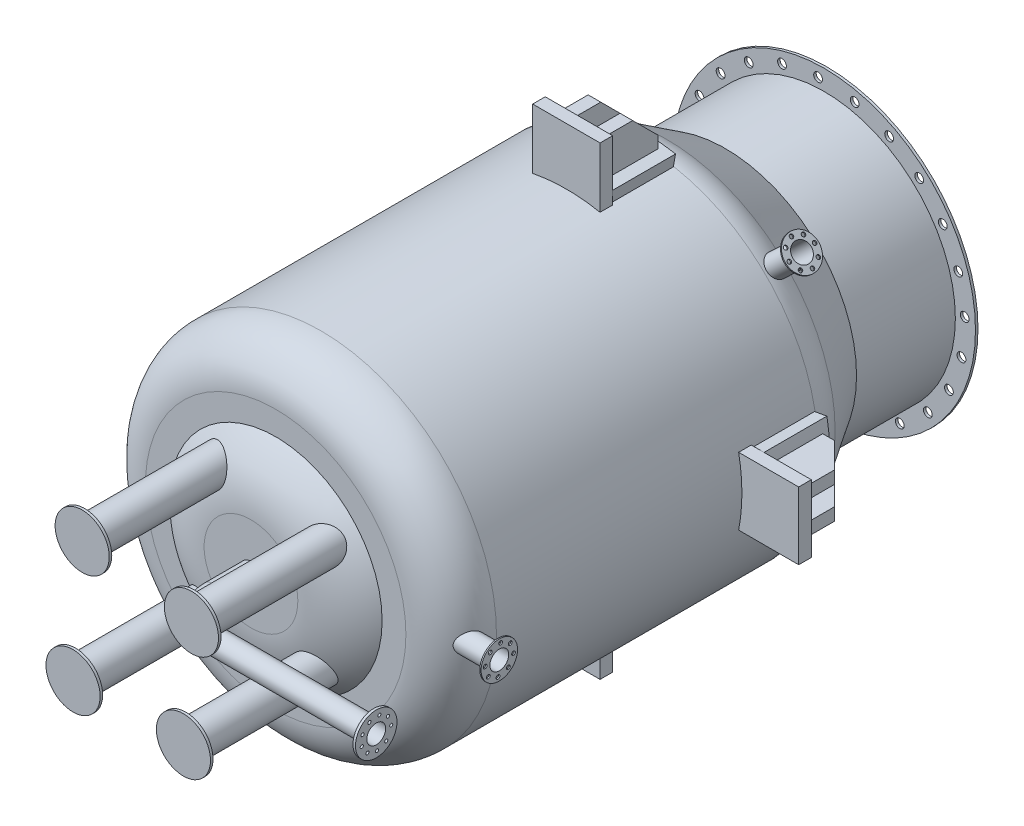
SolidWorks part; units mm, degrees
ref_plane "Ebene vorne" through (0, 0, 0) normal (0, 0, 1) x (1, 0, 0)
ref_plane "Ebene oben" through (0, 0, 0) normal (0, 1, 0) x (1, 0, 0)
ref_plane "Ebene rechts" through (0, 0, 0) normal (1, 0, 0) x (0, 0, -1)
sketch "Skizze4" plane through (0, 0, 0) normal (0, 0, 1) x (1, 0, 0)
  circle A0 centre (0, 0) radius 1042.5
  dimension "D1" = 2085
extrude "Linear austragen1" add sketch "Skizze4" along normal blind 4577
fillet "Verrundung1" radius 670 1 edges at (1042.5, 0, 4577)
shell "Wandung1" thickness 10
sketch "Skizze5" plane through (0, 0, 4577) normal (0, 0, 1) x (1, 0, 0)
  circle A0 centre (0, 0) radius 75
  dimension "D1" = 150
extrude "Linear austragen2" cut sketch "Skizze5" against normal up to next
sketch "Skizze8" plane through (0, 0, 0) normal (0, 1, 0) x (1, 0, 0)
  line L0 (1579.724, -5180.9866) -> (299, -5180.9866)
  line L1 (0, -4881.9866) -> (0, -4567)
  line L2 (75, -4567) -> (-75, -4567) construction
  arc A0 (299, -5180.9866) -> (0, -4881.9866) centre (299, -4881.9866) cw
  dimension "D1" = 299
ref_plane "Ebene2" through (1579.724, 0, 5180.9866) normal (-1, 0, 0) x (0, 0, 1)
sketch "Skizze11" plane through (1579.724, 0, 5180.9866) normal (-1, 0, 0) x (0, 0, 1)
  circle A0 centre (0, 0) radius 75
  dimension "D1" = 150
sweep "Austragung-Dünn2" add profiles "Skizze11" path "Skizze8" parameters "D1"=11
fillet "Verrundung5" radius 20 1 edges at (75, 0, 4567)
sketch "Skizze20" plane through (1579.724, 0, 5180.9866) normal (-1, 0, 0) x (0, 0, 1)
  circle A0 centre (0, 0) radius 75 construction
  circle A2 centre (0, 0) radius 75
  circle A3 centre (0, 0) radius 165
  dimension "D1" = 90
extrude "Linear austragen9" add sketch "Skizze20" against normal blind 20
sketch "Skizze21" plane through (1599.724, 0, 0) normal (1, 0, 0) x (0, 0, -1)
  circle A0 centre (-5061.9812, 0) radius 12.5
  dimension "D1" = 25
extrude "Linear austragen10" cut sketch "Skizze21" against normal up to next
pattern_circular "Kreismuster4" count 9 every 39 about axis through (0, 0, 5180.9866) along (1, 0, 0) of "Linear austragen10"
ref_plane "Ebene6" through (0, 0, 5531.373) normal (0, 0, 1) x (1, 0, 0)
sketch "Skizze23" plane through (0, 0, 5531.373) normal (0, 0, 1) x (1, 0, 0)
  circle A0 centre (-367.5803, 527.9889) radius 125.1685
extrude "Linear-Austragen-Dünn3" add sketch "Skizze23" against normal up to next thin
sketch "Skizze24" plane through (0, 0, 5531.373) normal (0, 0, 1) x (1, 0, 0)
  circle A2 centre (-367.5803, 527.9889) radius 215.1685
  circle A3 centre (-367.5803, 527.9889) radius 215.1685
  dimension "D1" = 90
extrude "Linear austragen11" add sketch "Skizze24" along normal blind 20
pattern_circular "Kreismuster5" count 4 every 86 about axis through (0, 0, 0) along (0, 0, 1) of "Linear-Austragen-Dünn3", "Linear austragen11"
sketch "Skizze28" plane through (0, 0, 0) normal (1, 0, 0) x (0, 0, -1)
  line L0 (0, 1042.5) -> (-3907, 1042.5) construction
  line L1 (-805.5154, 1042.5) -> (-880.0993, 1042.5)
  line L2 (-4380.7615, 846.2615) -> (-4380.7615, 1035.3621)
  line L3 (-4020.7615, 1395.3621) -> (-1465.537, 1395.3621)
  line L4 (-1272.4658, 1339.2099) -> (-805.5154, 1042.5)
  line L5 (-4340.7615, 883.1378) -> (-4340.7615, 1035.3621)
  line L6 (-4020.7615, 1355.3621) -> (-1465.537, 1355.3621)
  line L7 (-1293.9182, 1305.4491) -> (-880.0993, 1042.5)
  line L9 (-1293.9182, 1305.4491) -> (-826.9678, 1008.7391) construction
  line L10 (-4340.7615, 846.2615) -> (-4340.7615, 1035.3621) construction
  arc A0 (-3907, 1042.5) -> (-4577, 372.5) centre (-3907, 372.5) ccw construction
  arc A1 (-4340.7615, 883.1378) -> (-4380.7615, 846.2615) centre (-3907, 372.5) ccw
  arc A2 (-1465.537, 1395.3621) -> (-1272.4658, 1339.2099) centre (-1465.537, 1035.3621) cw
  arc A3 (-4380.7615, 1035.3621) -> (-4020.7615, 1395.3621) centre (-4020.7615, 1035.3621) cw
  arc A4 (-4340.7615, 1035.3621) -> (-4020.7615, 1355.3621) centre (-4020.7615, 1035.3621) cw
  arc A5 (-1465.537, 1355.3621) -> (-1293.9182, 1305.4491) centre (-1465.537, 1035.3621) cw
  dimension "D1" = 360
  dimension "D2" = 40
revolve "Rotation2" add sketch "Skizze28" angle 360 about axis through (0, 0, 4577) along (0, 0, -1)
sketch "Skizze31" plane through (0, 0, 0) normal (0, 0, 1) x (1, 0, 0)
  circle A0 centre (0, 0) radius 1032.5 construction
  circle A1 centre (0, 0) radius 1032.5
  circle A2 centre (0, 0) radius 1202.5
  dimension "D1" = 170
extrude "Linear austragen12" add sketch "Skizze31" along normal blind 20 separate body
sketch "Skizze32" plane through (0, 0, 0) normal (0, 0, -1) x (-1, 0, 0)
  line L0 (1146.8786, -361.4909) -> (984.7419, -310.3862) construction
  circle A0 centre (1065.8103, -335.9386) radius 35
  circle A1 centre (0, 0) radius 1202.5 construction
  circle A2 centre (0, 0) radius 1032.5 construction
  dimension "D1" = 70
extrude "Linear austragen13" cut sketch "Skizze32" against normal up to next
pattern_circular "Kreismuster6" count 24 over 360 about axis through (0, 0, 0) along (0, 0, 1) of "Linear austragen13"
ref_plane "Ebene7" through (0, 0, 1469.7557) normal (0, 0, 1) x (1, 0, 0)
sketch "Skizze33" plane through (0, 0, 1469.7557) normal (0, 0, 1) x (1, 0, 0)
  circle A0 centre (0, 0) radius 1395.3621 construction
  arc A1 (249.9384, 1372.795) -> (-249.9384, 1372.795) centre (0, 0) ccw
extrude "Linear-Austragen-Dünn4" add sketch "Skizze33" along normal blind 500 thin
ref_plane "Ebene8" through (0, 1846.8043, 0) normal (0, 1, 0) x (-1, 0, 0)
sketch "Skizze34" plane through (0, 1846.8043, 0) normal (0, 1, 0) x (-1, 0, 0)
  line L0 (267.8505, 1969.7557) -> (-267.8505, 1969.7557) construction
  line L1 (267.8505, 1969.7557) -> (-267.8505, 1969.7557)
extrude "Linear-Austragen-Dünn5" add sketch "Skizze34" against normal up to next thin
ref_plane "Ebene9" through (126.8043, 0, 0) normal (1, 0, 0) x (0, 0, -1)
ref_plane "Ebene10" through (-126.8043, 0, 0) normal (1, 0, 0) x (0, 0, -1)
sketch "Skizze35" plane through (126.8043, 0, 0) normal (1, 0, 0) x (0, 0, -1)
  line L0 (-1516.6155, 1471.1777) -> (-1516.6155, 1577.3802)
  line L1 (-1969.7557, 1471.1777) -> (-1469.7557, 1471.1777) construction
  line L2 (-1516.6155, 1577.3802) -> (-1719.7557, 1780.5204)
  line L3 (-1719.7557, 1780.5204) -> (-1969.7557, 1780.5204)
  line L4 (-1969.7557, 1471.1777) -> (-1969.7557, 1846.8043) construction
sketch "Skizze36" plane through (-126.8043, 0, 0) normal (1, 0, 0) x (0, 0, -1)
  line L0 (-1719.7557, 1780.5204) -> (-1969.7557, 1780.5204) construction
  line L1 (-1516.6155, 1577.3802) -> (-1719.7557, 1780.5204) construction
  line L2 (-1516.6155, 1471.1777) -> (-1516.6155, 1577.3802) construction
  line L3 (-1719.7557, 1780.5204) -> (-1969.7557, 1780.5204)
  line L4 (-1516.6155, 1577.3802) -> (-1719.7557, 1780.5204)
  line L5 (-1516.6155, 1471.1777) -> (-1516.6155, 1577.3802)
rib "Verstärkungsrippe2" sketch "Skizze36" sketch "Skizze36" thickness 100 extrusion direction parallel to sketch draft on no parameters "D1"=100
rib "Verstärkungsrippe3" sketch "Skizze35" sketch "Skizze35" thickness 100 extrusion direction parallel to sketch draft on no parameters "D1"=100
pattern_circular "Kreismuster7" count 3 every 90 about axis through (0, 0, 0) along (0, 0, 1) of "Verstärkungsrippe2", "Verstärkungsrippe3", "Linear-Austragen-Dünn5", "Linear-Austragen-Dünn4"
sketch "Skizze37" plane through (0, 0, 1469.7557) normal (0, 0, 1) x (1, 0, 0)
  line L0 (921.5315, 487.4279) -> (1198.09, 633.7087)
  line L1 (1209.0246, 612.5895) -> (929.942, 471.1837)
  circle A0 centre (0, 0) radius 1355.3621 construction
  arc A1 (1209.0246, 612.5895) -> (1198.09, 633.7087) centre (0, 0) ccw
  circle A2 centre (0, 0) radius 1042.5 construction
  arc A3 (929.942, 471.1837) -> (921.5315, 487.4279) centre (0, 0) ccw
extrude "Linear austragen14" add sketch "Skizze37" along normal up to next and the other way up to next
ref_plane "Ebene13" through (925.7368, 479.3058, 0) normal (0.888, 0.4598, 0) x (0, 0, -1)
sketch "trennboden untere ecke" plane through (925.7368, 479.3058, 0) normal (0.888, 0.4598, 0) x (0, 0, -1)
  line L2 (-3907, 9.1462) -> (-4340.6819, 9.1462) construction
  line L3 (-3907, -9.1462) -> (-4340.6819, -9.1462) construction
  line L5 (-4340.6819, 9.1462) -> (-4340.6819, -9.1462) construction
  line L6 (-3907, 9.1462) -> (-3907, -9.1462) construction
  line L7 (-3907, 9.1462) -> (-3907, -9.1462)
  line L8 (-4340.6819, 9.1462) -> (-4340.6819, -9.1462)
  line L9 (-3907, 9.1462) -> (-4340.6819, 9.1462)
  line L10 (-3907, -9.1462) -> (-4340.6819, -9.1462)
sketch "Skizze43" plane through (1579.724, 0, 5180.9866) normal (-1, 0, 0) x (0, 0, 1)
  circle A0 centre (-998.3711, 0) radius 75
  dimension "D1" = 150
extrude "Linear austragen24" cut sketch "Skizze43" along normal up to next
sketch "Skizze44" plane through (1579.724, 0, 5180.9866) normal (-1, 0, 0) x (0, 0, 1)
  circle A0 centre (-998.3711, 0) radius 75 construction
  circle A1 centre (-998.3711, 0) radius 75
  circle A2 centre (-998.3711, 0) radius 85
  dimension "D1" = 10
extrude "Linear austragen33" add sketch "Skizze44" along normal up to next
sketch "Skizze45" plane through (1579.724, 0, 5180.9866) normal (-1, 0, 0) x (0, 0, 1)
  circle A0 centre (-998.3711, 0) radius 85 construction
  circle A1 centre (-998.3711, 0) radius 85
  circle A2 centre (-998.3711, 0) radius 145
  dimension "D1" = 60
extrude "Linear austragen34" add sketch "Skizze45" along normal blind 10
sketch "Skizze46" plane through (1579.724, 0, 0) normal (1, 0, 0) x (0, 0, -1)
  circle A0 centre (-4070.0999, -10.4255) radius 15
  dimension "D1" = 30
extrude "Linear austragen35" cut sketch "Skizze46" against normal up to next
pattern_circular "Kreismuster8" count 8 over 360 about axis through (0, 0, 4182.6154) along (1, 0, 0) of "Linear austragen35"
sketch "Skizze47" plane through (0, 0, 0) normal (0, 0, 1) x (1, 0, 0)
  line L0 (0, 0) -> (1212.2564, 1136.9956) construction
  dimension "D1" = 1662.0243
ref_plane "Ebene14" through (1212.2564, 1136.9956, 0) normal (0.7294, 0.6841, 0) x (0, 0, -1)
sketch "Skizze48" plane through (1212.2564, 1136.9956, 0) normal (0.7294, 0.6841, 0) x (0, 0, -1)
  circle A0 centre (-1361.4307, 69.5167) radius 75
  dimension "D1" = 150
extrude "Linear austragen37" cut sketch "Skizze48" against normal up to next
sketch "Skizze51" plane through (1212.2564, 1136.9956, 0) normal (0.7294, 0.6841, 0) x (0, 0, -1)
  circle A0 centre (-1361.4307, 69.5167) radius 75 construction
  circle A1 centre (-1361.4307, 69.5167) radius 75
  circle A2 centre (-1361.4307, 69.5167) radius 85
  dimension "D1" = 10
extrude "Linear austragen38" add sketch "Skizze51" against normal up to next
sketch "Skizze52" plane through (1212.2564, 1136.9956, 0) normal (0.7294, 0.6841, 0) x (0, 0, -1)
  circle A0 centre (-1361.4307, 69.5167) radius 75 construction
  circle A1 centre (-1361.4307, 69.5167) radius 75
  circle A2 centre (-1361.4307, 69.5167) radius 135
  dimension "D1" = 60
extrude "Linear austragen39" add sketch "Skizze52" against normal blind 10
sketch "Skizze53" plane through (1212.2564, 1136.9956, 0) normal (0.7294, 0.6841, 0) x (0, 0, -1)
  circle A0 centre (-1444.4299, 138.3491) radius 15
  dimension "D1" = 30
extrude "Linear austragen40" cut sketch "Skizze53" against normal up to next
pattern_circular "Kreismuster9" count 8 over 360 about axis through (-47.5566, 50.7045, 1361.4307) along (0.7294, 0.6841, 0) of "Linear austragen40"
